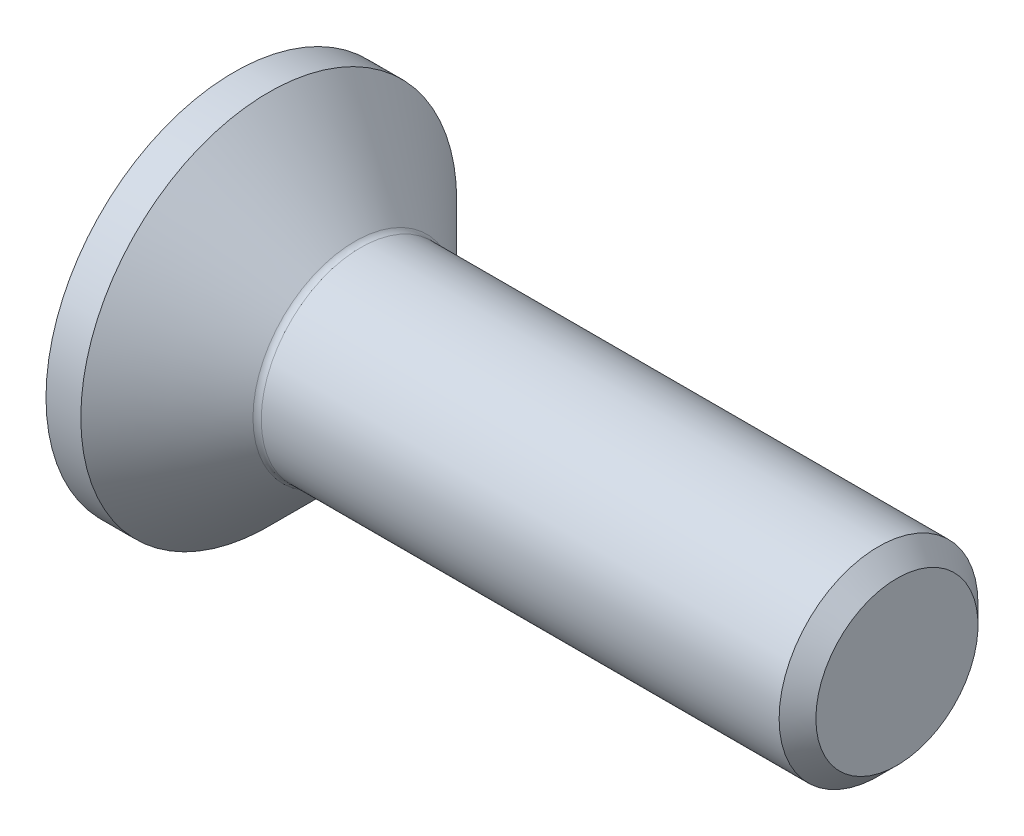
SolidWorks part; units mm, degrees
ref_plane "Plane1" through (0, 0, 0) normal (0, 0, 1) x (1, 0, 0)
ref_plane "Plane2" through (0, 0, 0) normal (0, 1, 0) x (1, 0, 0)
ref_plane "Plane3" through (0, 0, 0) normal (1, 0, 0) x (0, 0, -1)
sketch "BodySke" plane through (0, 0, 0) normal (0, 0, 1) x (1, 0, 0)
  line L0 (0, 0) -> (0, 5.67)
  line L1 (1.05, 5.67) -> (3.72, 3)
  line L2 (0, 5.67) -> (1.05, 5.67)
  line L3 (3.72, 3) -> (19.4455, 3)
  line L4 (20, 2.4455) -> (20, 0)
  line L5 (20, 0) -> (0, 0)
  line L6 (0, 0) -> (127, 0) construction
  line L7 (1.05, -5.67) -> (3.72, -3) construction
  line L8 (20, 2.4455) -> (19.4455, 3)
  line L9 (0, -5.67) -> (1.05, -5.67) construction
  line L10 (20, -2.4455) -> (19.4455, -3) construction
  line L11 (4.72, 9.35) -> (4.72, -12.875) construction
  line L12 (0, 19.05) -> (0, -3.175) construction
  dimension "D1" = 1.05
  dimension "Diameter" = 6
  dimension "Head_ht" = 3.72
  dimension "Length" = 20
  dimension "Body_ch_ang" = 45
  dimension "Head_dia" = 11.34
  dimension "Minor_dia" = 4.891
  dimension "Head_ang" = 90
  dimension "Advance" = 1
  dimension "Thread_nom" = 20
revolve "BaseBody" add sketch "BodySke"
fillet "Fillet1" radius 0.25 1 edges at (3.72, 0, 3)
sketch "Sketch2" plane through (0, 0, 0) normal (0, 0, 1) x (1, 0, 0)
  line L0 (0, 2) -> (2.2, 2)
  line L1 (2.2, 2) -> (3.3547, 0)
  line L2 (0, 0) -> (127, 0) construction
  line L3 (3.3547, 0) -> (0, 0)
  line L4 (0, 0) -> (0, 2)
  line L5 (0, -2) -> (2.2, -2) construction
  line L6 (0, 0) -> (47.625, 0) construction
  line L8 (0, 5.67) -> (0, -5.67) construction
  dimension "D2" = 60
  dimension "PreBroach_depth" = 2.2
  dimension "PreBroach_dia" = 4
revolve "PreBroach" cut sketch "Sketch2" angle 360 about L6
sketch "Sketch3" plane through (0, 0, 0) normal (-1, 0, 0) x (0, 0, 1)
  line L0 (-2, -1.1547) -> (-2, 1.1547)
  line L1 (-2, 1.1547) -> (0, 2.3094)
  line L2 (0, 2.3094) -> (2, 1.1547)
  line L3 (2, 1.1547) -> (2, -1.1547)
  line L4 (2, -1.1547) -> (0, -2.3094)
  line L5 (0, -2.3094) -> (-2, -1.1547)
  dimension "D1" = 2
  dimension "D2" = 2
  dimension "D3" = 4
  dimension "Hex_size" = 4
extrude "Hex" cut sketch "Sketch3" against normal blind 2.2
sketch "ThdSchSke" plane through (0, 0, 0) normal (0, 0, 1) x (1, 0, 0)
  line L0 (6.72, -2.4455) -> (6.3317, -3)
  line L1 (6.72, -2.4455) -> (7.1083, -3)
  line L2 (7.1083, -3) -> (7.1083, -3.75)
  line L3 (-3.175, 0) -> (5.1513, 0) construction
  line L4 (0, 5.67) -> (0, -5.67) construction
  line L5 (7.1083, -3.75) -> (6.3317, -3.75)
  line L6 (6.3317, -3.75) -> (6.3317, -3)
  dimension "Thread_minor" = 4.891
  dimension "Diameter" = 6
  dimension "Start" = 6.72
  dimension "SideAngle" = 55
  dimension "VeeAngle" = 70
  dimension "Overcut" = 7.5
revolve "ThreadSchematic" [suppressed] cut sketch "ThdSchSke" angle 360 about L3
pattern_linear "ThdSchPat" [suppressed]
equation "\"Thread_minor@ThreadCosmetic\"  =  \"Minor_dia@BodySke\""
equation "\"D1@Sketch3\" = \"Hex_size@Sketch3\" / 2"
equation "\"D2@Sketch3\" = \"D1@Sketch3\""
equation "\"D3@Sketch3\" = \"Hex_size@Sketch3\""
equation "\"Thread_length@ThreadCosmetic\" = ((sgn( (\"Length@BodySke\" - \"Advance@BodySke\" * 3.0 - \"Head_ht@BodySke\" ) - \"Thread_nom@BodySke\" )-1)*( (\"Length@BodySke\" - \"Advance@BodySke\" * 3.0 - \"Head_ht@BodySke\" "
equation "\"Thread_minor@ThdSchSke\" = \"Minor_dia@BodySke\""
equation "\"Diameter@ThdSchSke\" = \"Diameter@BodySke\""
equation "\"Overcut@ThdSchSke\" = \"Diameter@BodySke\" * 1.25"
equation "\"Start@ThdSchSke\" = 0.000001 + \"Length@BodySke\" - \"Thread_length@ThreadCosmetic\"  '---Countersunk---"
equation "\"Num_threads@ThdSchPat\" = int( \"Thread_length@ThreadCosmetic\" / \"Advance@BodySke\" + 0.999 )  + 1"
equation "\"Advance@ThdSchPat\" = \"Thread_length@ThreadCosmetic\" /  (\"Num_threads@ThdSchPat\" - 1) 'relax it"
equation "\"Num_threads@ThdSchPat\" = \"Num_threads@ThdSchPat\" - sgn( \"Num_threads@ThdSchPat\" - 1) '---chamfered tips only---"
